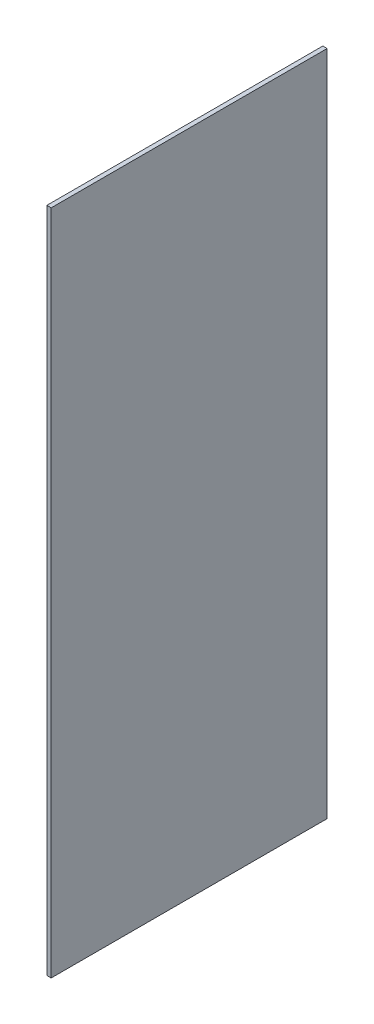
SolidWorks part; units mm, degrees
ref_plane "Front Plane" through (0, 0, 0) normal (1, 0, 0) x (0, 1, 0)
ref_plane "Top Plane" through (0, 0, 0) normal (0, 0, 1) x (0, 1, 0)
ref_plane "Right Plane" through (0, 0, 0) normal (0, 1, 0) x (-1, 0, 0)
sketch "Sketch1" plane through (0, 0, 0) normal (0, 1, 0) x (-1, 0, 0)
  line L1 (-4.7625, 304.8) -> (4.7625, 304.8)
  line L2 (-4.7625, 304.8) -> (-4.7625, -304.8)
  line L3 (-4.7625, -304.8) -> (4.7625, -304.8)
  line L4 (4.7625, 304.8) -> (4.7625, -304.8)
  line L5 (-4.7625, 304.8) -> (4.7625, -304.8) construction
  line L6 (-4.7625, -304.8) -> (4.7625, 304.8) construction
  point P0 (0, 0)
  dimension "D1" = 609.6
  dimension "D2" = 9.525
extrude "Boss-Extrude1" add sketch "Sketch1" along normal blind 1473.2
